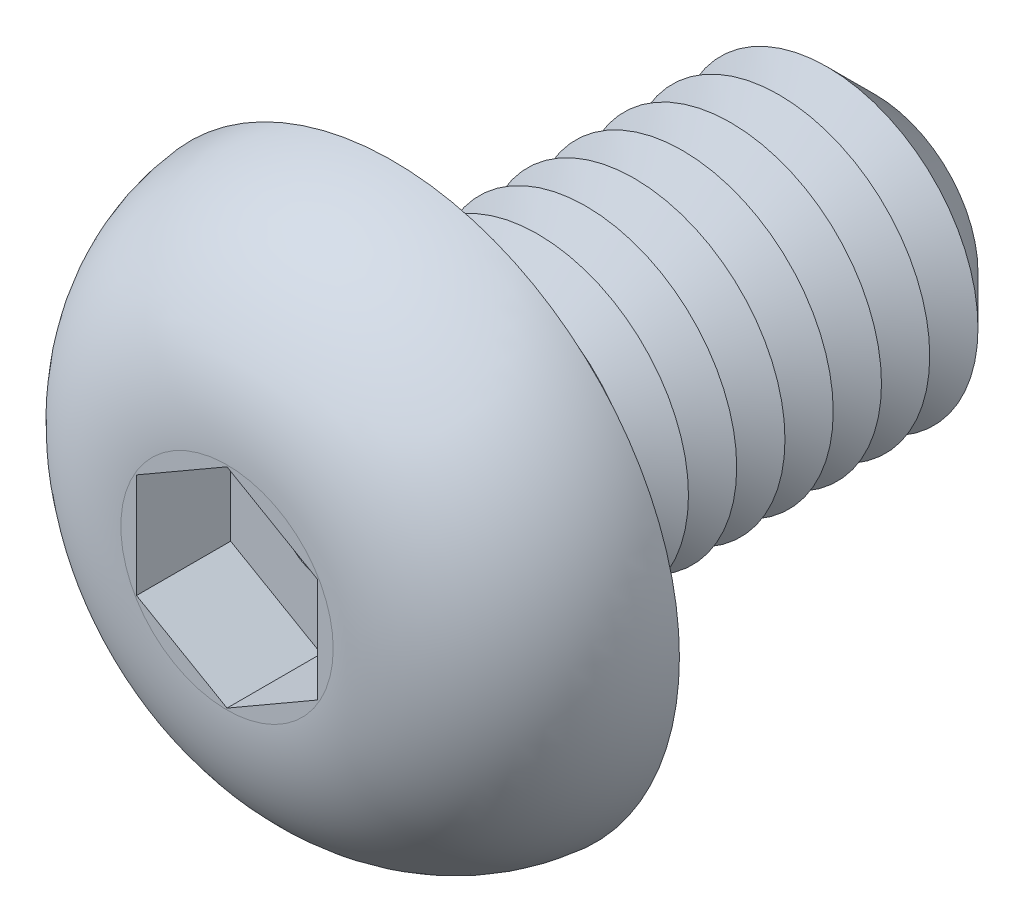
SolidWorks part; units mm, degrees
ref_plane "Front Plane" through (0, 0, 0) normal (0, 0, 1) x (1, 0, 0)
ref_plane "Top Plane" through (0, 0, 0) normal (0, 1, 0) x (1, 0, 0)
ref_plane "Right Plane" through (0, 0, 0) normal (1, 0, 0) x (0, 0, -1)
sketch "Sketch1" plane through (0, 0, 0) normal (1, 0, 0) x (0, 0, -1)
  line L0 (-47.9342, 0) -> (60.3146, 0) construction
sketch "Sketch2" plane through (0, 0, 0) normal (1, 0, 0) x (0, 0, -1)
  line L0 (0, 0) -> (-2.75, 0)
  line L1 (-47.9342, 0) -> (60.3146, 0) construction
  line L2 (-2.75, 0) -> (-2.75, 1.7604)
  line L3 (0, 4.75) -> (0, 0)
  arc A0 (-2.75, 1.7604) -> (0, 4.75) centre (0.25, 1.7604) cw
  dimension "D1" = 3
  dimension "D2" = 2.75
  dimension "D3" = 4.75
revolve "Revolve1" add sketch "Sketch2" angle 360 about L0
sketch "Sketch3" plane through (0, 0, 2.75) normal (0, 0, 1) x (1, 0, 0)
  line L1 (0, 1.7321) -> (-1.5, 0.866)
  line L2 (-1.5, 0.866) -> (-1.5, -0.866)
  line L3 (-1.5, -0.866) -> (0, -1.7321)
  line L4 (0, -1.7321) -> (1.5, -0.866)
  line L5 (1.5, -0.866) -> (1.5, 0.866)
  line L6 (1.5, 0.866) -> (0, 1.7321)
  circle A0 centre (0, 0) radius 1.5 construction
  dimension "D1" = 3
extrude "Cut-Extrude1" cut sketch "Sketch3" against normal blind 1.56
sketch "Sketch4" plane through (0, 0, 0) normal (0, 0, -1) x (-1, 0, 0)
  circle A0 centre (0, 0) radius 2.5
  dimension "D1" = 5
extrude "Boss-Extrude1" add sketch "Sketch4" along normal blind 8
chamfer "Chamfer1" distance 0.8 angle 45 1 edges at (-2.5, 0, -8)
sketch "Sketch5" plane through (0, 0, 0) normal (1, 0, 0) x (0, 0, -1)
  line L0 (0.8, 2.5) -> (1.6, 2.5)
  line L1 (7.2, 2.5) -> (0, 2.5) construction
  line L2 (1.6, 2.5) -> (1.2, 1.8072)
  line L3 (1.2, 1.8072) -> (0.8, 2.5)
  line L4 (0, -4.75) -> (0, 4.75) construction
  line L5 (7.2, 2.5) -> (0, 2.5) construction
  dimension "D1" = 0.8
  dimension "D2" = 0.8
revolve "Cut-Revolve1" cut sketch "Sketch5" angle 360 about L0
pattern_linear "LPattern1" count 8 spacing 0.8 along (0, 0, -1) of "Cut-Revolve1"
fillet "Fillet2" radius 0.4 1 edges at (2.5, 0, 0)
sketch "Sketch6" plane through (0, 0, 1.19) normal (0, 0, 1) x (1, 0, 0)
  circle A0 centre (0, 0) radius 0.65
  dimension "D1" = 1.3
extrude "Cut-Extrude2" cut sketch "Sketch6" against normal up to surface (9.19 mm away)
